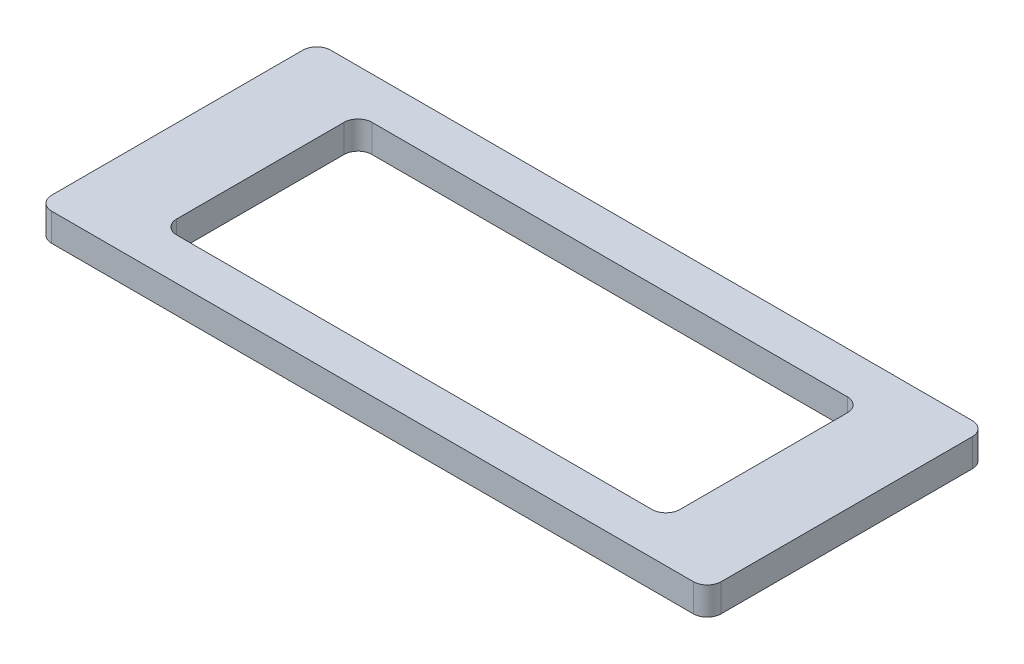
SolidWorks part; units mm, degrees
ref_plane "Front" through (0, 0, 0) normal (0, 0, 1) x (1, 0, 0)
ref_plane "Top" through (0, 0, 0) normal (0, 1, 0) x (1, 0, 0)
ref_plane "Right" through (0, 0, 0) normal (1, 0, 0) x (0, 0, -1)
sketch "Sketch1" plane through (0, 0, 0) normal (0, 1, 0) x (1, 0, 0)
  line L0 (0, 22.225) -> (32.5815, 22.225) construction
  line L1 (3.175, 0) -> (111.379, 0)
  line L2 (0, 3.175) -> (0, 41.275)
  line L3 (3.175, 44.45) -> (111.379, 44.45)
  line L4 (114.554, 3.175) -> (114.554, 41.275)
  line L5 (-6.35, 53.975) -> (120.904, 53.975)
  line L7 (-6.35, -9.525) -> (120.904, -9.525)
  line L10 (-15.748, -9.525) -> (130.302, -9.525)
  line L11 (-18.923, -6.35) -> (-18.923, 50.8)
  line L12 (-15.748, 53.975) -> (130.302, 53.975)
  line L13 (133.477, -6.35) -> (133.477, 50.8)
  arc A0 (111.379, 0) -> (114.554, 3.175) centre (111.379, 3.175) ccw
  arc A1 (111.379, 44.45) -> (114.554, 41.275) centre (111.379, 41.275) cw
  arc A2 (0, 41.275) -> (3.175, 44.45) centre (3.175, 41.275) cw
  arc A3 (3.175, 0) -> (0, 3.175) centre (3.175, 3.175) cw
  arc A8 (133.477, 50.8) -> (130.302, 53.975) centre (130.302, 50.8) ccw
  arc A9 (130.302, -9.525) -> (133.477, -6.35) centre (130.302, -6.35) ccw
  arc A10 (-18.923, -6.35) -> (-15.748, -9.525) centre (-15.748, -6.35) ccw
  arc A11 (-15.748, 53.975) -> (-18.923, 50.8) centre (-15.748, 50.8) ccw
  point P7 (114.554, 0)
  point P12 (0, 44.45)
  point P15 (0, 0)
  dimension "D3" = 3.175
  dimension "D13" = 3.175
  dimension "D1" = 44.45
  dimension "D2" = 114.554
  dimension "D4" = 9.525
  dimension "D5" = 9.525
  dimension "D6" = 18.923
  dimension "D9" = 152.4
  dimension "D10" = 63.5
  dimension "D11" = 9.525
extrude "Extrude1" add sketch "Sketch1" along normal blind 6.35 contours L12 A11 L11 A10 L10 L7 A9 L13 A8 L5 L1 A3 L2 A2 L3 A1 L4 A0
sketch "Sketch2" plane through (0, 0, 0) normal (0, -1, 0) x (1, 0, 0)
  circle A0 centre (103.1233, -47.625) radius 1.651
  circle A1 centre (57.4033, -47.625) radius 1.651
  circle A2 centre (11.6833, -47.625) radius 1.651
  circle A3 centre (103.1233, 3.175) radius 1.651
  circle A4 centre (57.4033, 3.175) radius 1.651
  circle A5 centre (11.6833, 3.175) radius 1.651
extrude "Cut-Extrude1" cut sketch "Sketch2" against normal blind 1.5875
